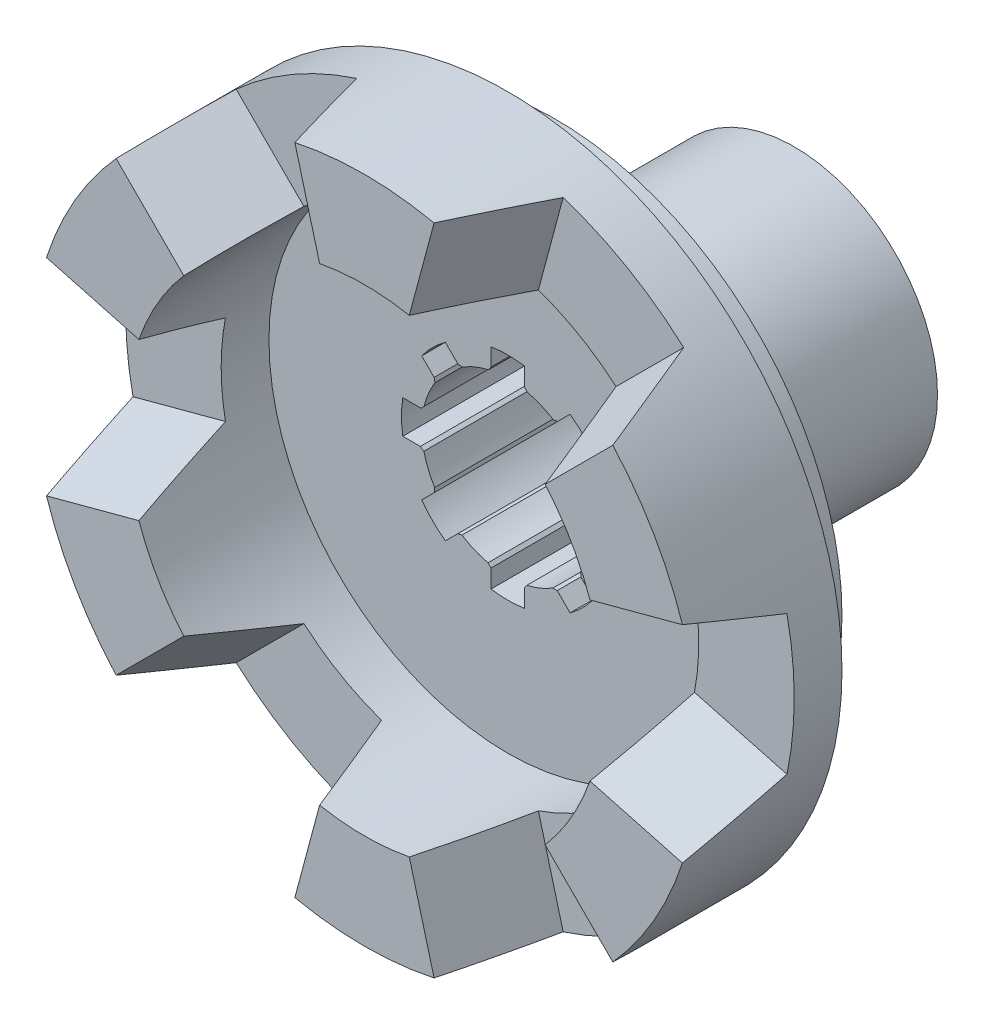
SolidWorks part; units mm, degrees
ref_plane "Płaszczyzna przednia" through (0, 0, 0) normal (0, 0, 1) x (1, 0, 0)
ref_plane "Płaszczyzna górna" through (0, 0, 0) normal (0, 1, 0) x (1, 0, 0)
ref_plane "Płaszczyzna prawa" through (0, 0, 0) normal (1, 0, 0) x (0, 0, -1)
sketch "Szkic1" plane through (0, 0, 0) normal (0, 0, 1) x (1, 0, 0)
  line L0 (-18.1173, 67.6148) -> (-12.941, 48.2963)
  line L1 (18.1173, 67.6148) -> (12.941, 48.2963)
  line L2 (0, 0) -> (0, 50) construction
  arc A0 (18.1173, 67.6148) -> (-18.1173, 67.6148) centre (0, 0) ccw
  arc A1 (12.941, 48.2963) -> (-12.941, 48.2963) centre (0, 0) ccw
  dimension "D1" = 100
  dimension "D2" = 140
  dimension "D3" = 30
extrude "Dodanie-wyciągnięcie1" add sketch "Szkic1" along normal mid plane 20
draft "Pochylenie1" type of draft neutral plane draft angle 20 neutral plane "Płaszczyzna przednia" faces to draft 2 parameters "D1"=20
pattern_circular "Szyk kołowy1" count 6 over 360 about axis through (0, 0, 0) along (0, 0, 1)
sketch "Szkic2" plane through (0, 0, -10) normal (0, 0, -1) x (-1, 0, 0)
  arc A0 (16.4223, 47.2261) -> (-16.4223, 47.2261) centre (0, 0) ccw construction
  arc A1 (21.6085, 66.5813) -> (-21.6085, 66.5813) centre (0, 0) ccw construction
  circle A2 centre (0, 0) radius 50
  circle A3 centre (0, 0) radius 70
extrude "Dodanie-wyciągnięcie2" add sketch "Szkic2" along normal blind 10
sketch "Szkic3" plane through (0, 0, 0) normal (1, 0, 0) x (0, 0, -1)
  line L0 (20, 60) -> (20, 18)
  line L1 (20, -70) -> (20, 70) construction
  line L2 (20, 18) -> (80, 18)
  line L3 (80, 18) -> (80, 30)
  line L4 (80, 30) -> (30, 30)
  line L5 (30, 30) -> (30, 60)
  line L6 (30, 60) -> (20, 60)
  line L7 (0, 0) -> (75.6892, 0) construction
  dimension "D1" = 36
  dimension "D2" = 60
  dimension "D3" = 120
  dimension "D4" = 10
  dimension "D5" = 60
revolve "Obrót1" add sketch "Szkic3" angle 360 about L7
sketch "Szkic4" plane through (0, 0, -80) normal (0, 0, -1) x (-1, 0, 0)
  line L0 (-3.5, 21.973) -> (-3.5, 17.6564)
  line L1 (-3.5, 17.6564) -> (3.5, 17.6564)
  line L2 (3.5, 17.6564) -> (3.5, 21.973)
  arc A0 (3.5, 21.973) -> (-3.5, 21.973) centre (0, 0) ccw
  circle A1 centre (0, 0) radius 18 construction
  dimension "D1" = 44.5
  dimension "D2" = 7
extrude "Wytnij-wyciągnięcie1" cut sketch "Szkic4" against normal through all
chamfer "Sfazowanie1" distance 0.5 angle 45 2 edges at (-3.5, 17.6564, -50) (3.5, 17.6564, -50)
pattern_circular "Szyk kołowy2" count 8 over 360 about axis through (0, 0, 0) along (0, 0, 1) of "Wytnij-wyciągnięcie1", "Sfazowanie1"
